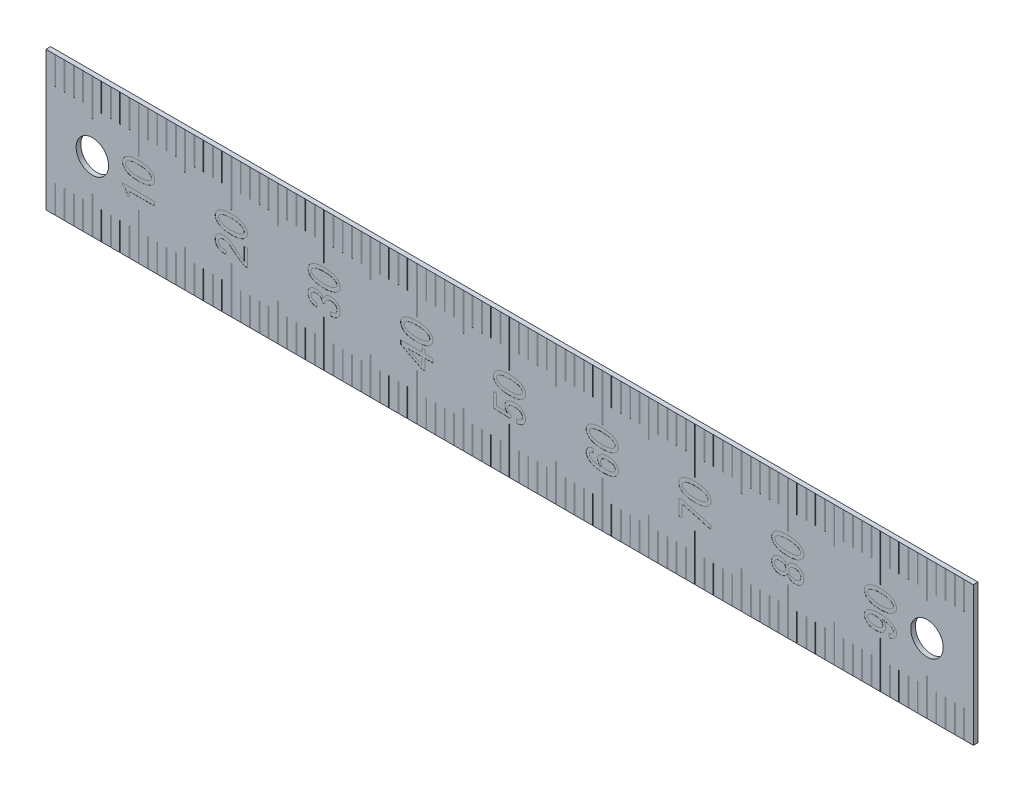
SolidWorks part; units mm, degrees
ref_plane "Front" through (0, 0, 0) normal (0, 0, 1) x (1, 0, 0)
ref_plane "Top" through (0, 0, 0) normal (0, 1, 0) x (1, 0, 0)
ref_plane "Right" through (0, 0, 0) normal (1, 0, 0) x (0, 0, -1)
sketch "Sketch1" plane through (0, 0, 0) normal (0, 0, 1) x (1, 0, 0)
  line L1 (0, -50) -> (0, 50)
  line L2 (0, -50) -> (15, -50)
  line L3 (15, -50) -> (15, 50)
  line L4 (0, 50) -> (15, 50)
  dimension "D1" = 100
  dimension "D2" = 15
extrude "Extrude1" add sketch "Sketch1" along normal blind 0.5
sketch "Sketch2" plane through (0, 0, 0.5) normal (0, 0, 1) x (1, 0, 0)
  line L0 (0, 50) -> (0, -50) construction
  line L1 (0, -50) -> (15, -50) construction
  line L2 (15, 50) -> (0, 50) construction
  circle A0 centre (7.5, -45) radius 1.75
  circle A1 centre (7.5, 45) radius 1.75
  dimension "D1" = 7.5
  dimension "D2" = 7.5
  dimension "D3" = 5
  dimension "D4" = 5
  dimension "D5" = 3.5
  dimension "D6" = 3.5
extrude "Extrude2" cut sketch "Sketch2" against normal through all
sketch "Sketch3" plane through (0, 0, 0.5) normal (0, 0, 1) x (1, 0, 0)
  line L0 (15, 50) -> (0, 50) construction
  line L1 (5.25, 28.25) -> (9.75, 28.25) construction
  line L2 (5.25, 18.25) -> (9.75, 18.25) construction
  line L3 (5.25, 8.25) -> (9.75, 8.25) construction
  line L5 (0, 50) -> (0, -50) construction
  line L6 (5.25, -1.75) -> (9.75, -1.75) construction
  line L7 (5.25, 38.25) -> (9.75, 38.25) construction
  line L8 (5.25, 38.25) -> (5.25, 41.75) construction
  line L9 (7.5, -50) -> (7.5, 50) construction
  line L10 (0, -50) -> (15, -50) construction
  line L11 (0, 40) -> (15, 40) construction
  line L12 (15, -50) -> (15, 50) construction
  line L13 (5.25, 41.75) -> (9.75, 41.75) construction
  line L14 (9.75, 38.25) -> (9.75, 41.75) construction
  line L15 (5.25, 38.25) -> (9.75, 41.75) construction
  line L16 (5.25, 41.75) -> (9.75, 38.25) construction
  line L17 (5.25, -11.75) -> (9.75, -11.75) construction
  line L18 (5.25, -21.75) -> (9.75, -21.75) construction
  line L19 (5.25, -31.75) -> (9.75, -31.75) construction
  line L20 (5.25, -41.75) -> (9.75, -41.75) construction
  circle A0 centre (7.5, 45) radius 1.75 construction
  text T0 "10" font "ＭＳ ゴシック" height 3.5
  text T1 "20" font "ＭＳ ゴシック" height 3.5
  text T2 "30" font "ＭＳ ゴシック" height 3.5
  text T3 "40" font "ＭＳ ゴシック" height 3.5
  text T4 "50  "
  text T5 "60"
  text T6 "70"
  text T7 "80"
  text T8 "90"
  point P7 (7.5, 40)
  dimension "D2" = 7.5
  dimension "D1" = 4
  dimension "D3" = 6
  dimension "D6" = 10
  dimension "D5" = 4.5
  dimension "D7" = 3.5
extrude "Extrude3" cut sketch "Sketch3" against normal blind 0.01
sketch "Sketch4" plane through (0, 0, 0.5) normal (0, 0, 1) x (1, 0, 0)
  line L0 (15, 40.05) -> (10, 40.05)
  line L1 (15, -50) -> (15, 50) construction
  line L2 (10, 40.05) -> (10, 39.95)
  line L3 (10, 39.95) -> (15, 39.95)
  line L4 (15, 39.95) -> (15, 40.05)
  line L5 (15, 50) -> (0, 50) construction
  line L6 (15, 48.05) -> (15, 47.95)
  line L7 (15, 44.95) -> (11, 44.95)
  line L8 (15, 44.95) -> (15, 45.05)
  line L9 (15, 45.05) -> (11, 45.05)
  line L10 (11, 44.95) -> (11, 45.05)
  line L11 (15, 49.05) -> (12, 49.05)
  line L12 (15, 49.05) -> (15, 48.95)
  line L13 (15, 48.95) -> (12, 48.95)
  line L14 (12, 49.05) -> (12, 48.95)
  line L15 (15, 48.05) -> (12, 48.05)
  line L16 (15, 47.95) -> (12, 47.95)
  line L17 (12, 48.05) -> (12, 47.95)
  line L18 (15, 47.05) -> (15, 46.95)
  line L19 (15, 47.05) -> (12, 47.05)
  line L20 (15, 46.95) -> (12, 46.95)
  line L21 (12, 47.05) -> (12, 46.95)
  line L22 (15, 46.05) -> (15, 45.95)
  line L23 (15, 46.05) -> (12, 46.05)
  line L24 (15, 45.95) -> (12, 45.95)
  line L25 (12, 46.05) -> (12, 45.95)
  line L26 (15, 30.05) -> (10, 30.05)
  line L27 (10, 30.05) -> (10, 29.95)
  line L28 (10, 29.95) -> (15, 29.95)
  line L29 (15, 29.95) -> (15, 30.05)
  line L30 (15, 44.05) -> (15, 43.95)
  line L31 (15, 44.05) -> (12, 44.05)
  line L32 (15, 43.95) -> (12, 43.95)
  line L33 (12, 44.05) -> (12, 43.95)
  line L34 (15, 43.05) -> (15, 42.95)
  line L35 (15, 43.05) -> (12, 43.05)
  line L36 (15, 42.95) -> (12, 42.95)
  line L37 (12, 43.05) -> (12, 42.95)
  line L38 (15, 42.05) -> (15, 41.95)
  line L39 (15, 42.05) -> (12, 42.05)
  line L40 (15, 41.95) -> (12, 41.95)
  line L41 (12, 42.05) -> (12, 41.95)
  line L42 (15, 41.05) -> (15, 40.95)
  line L43 (15, 41.05) -> (12, 41.05)
  line L44 (15, 40.95) -> (12, 40.95)
  line L45 (12, 41.05) -> (12, 40.95)
  line L46 (12, 45.05) -> (12, 44.95)
  line L47 (15, 45.05) -> (12, 45.05)
  line L48 (15, 44.95) -> (12, 44.95)
  line L49 (15, 45.05) -> (15, 44.95)
  line L50 (15, 38.05) -> (15, 37.95)
  line L51 (15, 34.95) -> (11, 34.95)
  line L52 (15, 34.95) -> (15, 35.05)
  line L53 (15, 35.05) -> (11, 35.05)
  line L54 (11, 34.95) -> (11, 35.05)
  line L55 (15, 39.05) -> (12, 39.05)
  line L56 (15, 39.05) -> (15, 38.95)
  line L57 (15, 38.95) -> (12, 38.95)
  line L58 (12, 39.05) -> (12, 38.95)
  line L59 (15, 38.05) -> (12, 38.05)
  line L60 (15, 37.95) -> (12, 37.95)
  line L61 (12, 38.05) -> (12, 37.95)
  line L62 (15, 37.05) -> (15, 36.95)
  line L63 (15, 37.05) -> (12, 37.05)
  line L64 (15, 36.95) -> (12, 36.95)
  line L65 (12, 37.05) -> (12, 36.95)
  line L66 (15, 36.05) -> (15, 35.95)
  line L67 (15, 36.05) -> (12, 36.05)
  line L68 (15, 35.95) -> (12, 35.95)
  line L69 (12, 36.05) -> (12, 35.95)
  line L70 (15, 34.05) -> (15, 33.95)
  line L71 (15, 34.05) -> (12, 34.05)
  line L72 (15, 33.95) -> (12, 33.95)
  line L73 (12, 34.05) -> (12, 33.95)
  line L74 (15, 33.05) -> (15, 32.95)
  line L75 (15, 33.05) -> (12, 33.05)
  line L76 (15, 32.95) -> (12, 32.95)
  line L77 (12, 33.05) -> (12, 32.95)
  line L78 (15, 32.05) -> (15, 31.95)
  line L79 (15, 32.05) -> (12, 32.05)
  line L80 (15, 31.95) -> (12, 31.95)
  line L81 (12, 32.05) -> (12, 31.95)
  line L82 (15, 31.05) -> (15, 30.95)
  line L83 (15, 31.05) -> (12, 31.05)
  line L84 (15, 30.95) -> (12, 30.95)
  line L85 (12, 31.05) -> (12, 30.95)
  line L86 (15, 20.05) -> (10, 20.05)
  line L87 (10, 20.05) -> (10, 19.95)
  line L88 (10, 19.95) -> (15, 19.95)
  line L89 (15, 19.95) -> (15, 20.05)
  line L90 (15, 28.05) -> (15, 27.95)
  line L91 (15, 24.95) -> (11, 24.95)
  line L92 (15, 24.95) -> (15, 25.05)
  line L93 (15, 25.05) -> (11, 25.05)
  line L94 (11, 24.95) -> (11, 25.05)
  line L95 (15, 29.05) -> (12, 29.05)
  line L96 (15, 29.05) -> (15, 28.95)
  line L97 (15, 28.95) -> (12, 28.95)
  line L98 (12, 29.05) -> (12, 28.95)
  line L99 (15, 28.05) -> (12, 28.05)
  line L100 (15, 27.95) -> (12, 27.95)
  line L101 (12, 28.05) -> (12, 27.95)
  line L102 (15, 27.05) -> (15, 26.95)
  line L103 (15, 27.05) -> (12, 27.05)
  line L104 (15, 26.95) -> (12, 26.95)
  line L105 (12, 27.05) -> (12, 26.95)
  line L106 (15, 26.05) -> (15, 25.95)
  line L107 (15, 26.05) -> (12, 26.05)
  line L108 (15, 25.95) -> (12, 25.95)
  line L109 (12, 26.05) -> (12, 25.95)
  line L110 (15, 24.05) -> (15, 23.95)
  line L111 (15, 24.05) -> (12, 24.05)
  line L112 (15, 23.95) -> (12, 23.95)
  line L113 (12, 24.05) -> (12, 23.95)
  line L114 (15, 23.05) -> (15, 22.95)
  line L115 (15, 23.05) -> (12, 23.05)
  line L116 (15, 22.95) -> (12, 22.95)
  line L117 (12, 23.05) -> (12, 22.95)
  line L118 (15, 22.05) -> (15, 21.95)
  line L119 (15, 22.05) -> (12, 22.05)
  line L120 (15, 21.95) -> (12, 21.95)
  line L121 (12, 22.05) -> (12, 21.95)
  line L122 (15, 21.05) -> (15, 20.95)
  line L123 (15, 21.05) -> (12, 21.05)
  line L124 (15, 20.95) -> (12, 20.95)
  line L125 (12, 21.05) -> (12, 20.95)
  line L126 (15, 10.05) -> (10, 10.05)
  line L127 (10, 10.05) -> (10, 9.95)
  line L128 (10, 9.95) -> (15, 9.95)
  line L129 (15, 9.95) -> (15, 10.05)
  line L130 (15, 18.05) -> (15, 17.95)
  line L131 (15, 14.95) -> (11, 14.95)
  line L132 (15, 14.95) -> (15, 15.05)
  line L133 (15, 15.05) -> (11, 15.05)
  line L134 (11, 14.95) -> (11, 15.05)
  line L135 (15, 19.05) -> (12, 19.05)
  line L136 (15, 19.05) -> (15, 18.95)
  line L137 (15, 18.95) -> (12, 18.95)
  line L138 (12, 19.05) -> (12, 18.95)
  line L139 (15, 18.05) -> (12, 18.05)
  line L140 (15, 17.95) -> (12, 17.95)
  line L141 (12, 18.05) -> (12, 17.95)
  line L142 (15, 17.05) -> (15, 16.95)
  line L143 (15, 17.05) -> (12, 17.05)
  line L144 (15, 16.95) -> (12, 16.95)
  line L145 (12, 17.05) -> (12, 16.95)
  line L146 (15, 16.05) -> (15, 15.95)
  line L147 (15, 16.05) -> (12, 16.05)
  line L148 (15, 15.95) -> (12, 15.95)
  line L149 (12, 16.05) -> (12, 15.95)
  line L150 (15, 14.05) -> (15, 13.95)
  line L151 (15, 14.05) -> (12, 14.05)
  line L152 (15, 13.95) -> (12, 13.95)
  line L153 (12, 14.05) -> (12, 13.95)
  line L154 (15, 13.05) -> (15, 12.95)
  line L155 (15, 13.05) -> (12, 13.05)
  line L156 (15, 12.95) -> (12, 12.95)
  line L157 (12, 13.05) -> (12, 12.95)
  line L158 (15, 12.05) -> (15, 11.95)
  line L159 (15, 12.05) -> (12, 12.05)
  line L160 (15, 11.95) -> (12, 11.95)
  line L161 (12, 12.05) -> (12, 11.95)
  line L162 (15, 11.05) -> (15, 10.95)
  line L163 (15, 11.05) -> (12, 11.05)
  line L164 (15, 10.95) -> (12, 10.95)
  line L165 (12, 11.05) -> (12, 10.95)
  line L166 (7.5, 50) -> (7.5, 36.693) construction
  line L167 (3, 1.05) -> (3, 0.95)
  line L168 (0, 0.95) -> (3, 0.95)
  line L169 (0, 1.05) -> (3, 1.05)
  line L170 (15, 8.05) -> (15, 7.95)
  line L171 (15, 4.95) -> (11, 4.95)
  line L172 (15, 4.95) -> (15, 5.05)
  line L173 (15, 5.05) -> (11, 5.05)
  line L174 (11, 4.95) -> (11, 5.05)
  line L175 (15, 9.05) -> (12, 9.05)
  line L176 (15, 9.05) -> (15, 8.95)
  line L177 (15, 8.95) -> (12, 8.95)
  line L178 (12, 9.05) -> (12, 8.95)
  line L179 (15, 8.05) -> (12, 8.05)
  line L180 (15, 7.95) -> (12, 7.95)
  line L181 (12, 8.05) -> (12, 7.95)
  line L182 (15, 7.05) -> (15, 6.95)
  line L183 (15, 7.05) -> (12, 7.05)
  line L184 (15, 6.95) -> (12, 6.95)
  line L185 (12, 7.05) -> (12, 6.95)
  line L186 (15, 6.05) -> (15, 5.95)
  line L187 (15, 6.05) -> (12, 6.05)
  line L188 (15, 5.95) -> (12, 5.95)
  line L189 (12, 6.05) -> (12, 5.95)
  line L190 (15, 4.05) -> (15, 3.95)
  line L191 (15, 4.05) -> (12, 4.05)
  line L192 (15, 3.95) -> (12, 3.95)
  line L193 (12, 4.05) -> (12, 3.95)
  line L194 (15, 3.05) -> (15, 2.95)
  line L195 (15, 3.05) -> (12, 3.05)
  line L196 (15, 2.95) -> (12, 2.95)
  line L197 (12, 3.05) -> (12, 2.95)
  line L198 (15, 2.05) -> (15, 1.95)
  line L199 (15, 2.05) -> (12, 2.05)
  line L200 (15, 1.95) -> (12, 1.95)
  line L201 (12, 2.05) -> (12, 1.95)
  line L202 (15, 1.05) -> (15, 0.95)
  line L203 (15, 1.05) -> (12, 1.05)
  line L204 (15, 0.95) -> (12, 0.95)
  line L205 (12, 1.05) -> (12, 0.95)
  line L206 (15, 0.05) -> (10, 0.05)
  line L207 (10, 0.05) -> (10, -0.05)
  line L208 (10, -0.05) -> (15, -0.05)
  line L209 (15, -0.05) -> (15, 0.05)
  line L210 (0, 1.05) -> (0, 0.95)
  line L211 (3, 2.05) -> (3, 1.95)
  line L212 (0, 1.95) -> (3, 1.95)
  line L213 (0, 2.05) -> (3, 2.05)
  line L214 (0, 2.05) -> (0, 1.95)
  line L215 (3, 3.05) -> (3, 2.95)
  line L216 (0, 2.95) -> (3, 2.95)
  line L217 (0, 3.05) -> (3, 3.05)
  line L218 (0, 3.05) -> (0, 2.95)
  line L219 (3, 4.05) -> (3, 3.95)
  line L220 (0, 3.95) -> (3, 3.95)
  line L221 (0, 4.05) -> (3, 4.05)
  line L222 (0, 4.05) -> (0, 3.95)
  line L223 (3, 6.05) -> (3, 5.95)
  line L224 (0, 5.95) -> (3, 5.95)
  line L225 (0, 6.05) -> (3, 6.05)
  line L226 (0, 6.05) -> (0, 5.95)
  line L227 (3, 7.05) -> (3, 6.95)
  line L228 (0, 6.95) -> (3, 6.95)
  line L229 (0, 7.05) -> (3, 7.05)
  line L230 (0, 7.05) -> (0, 6.95)
  line L231 (3, 8.05) -> (3, 7.95)
  line L232 (0, 7.95) -> (3, 7.95)
  line L233 (0, 8.05) -> (3, 8.05)
  line L234 (3, 9.05) -> (3, 8.95)
  line L235 (0, 8.95) -> (3, 8.95)
  line L236 (0, 9.05) -> (0, 8.95)
  line L237 (0, 9.05) -> (3, 9.05)
  line L238 (4, 4.95) -> (4, 5.05)
  line L239 (0, 5.05) -> (4, 5.05)
  line L240 (0, 4.95) -> (0, 5.05)
  line L241 (0, 4.95) -> (4, 4.95)
  line L242 (0, 8.05) -> (0, 7.95)
  line L243 (3, 11.05) -> (3, 10.95)
  line L244 (0, 10.95) -> (3, 10.95)
  line L245 (0, 11.05) -> (3, 11.05)
  line L246 (0, 11.05) -> (0, 10.95)
  line L247 (3, 12.05) -> (3, 11.95)
  line L248 (0, 11.95) -> (3, 11.95)
  line L249 (0, 12.05) -> (3, 12.05)
  line L250 (0, 12.05) -> (0, 11.95)
  line L251 (3, 13.05) -> (3, 12.95)
  line L252 (0, 12.95) -> (3, 12.95)
  line L253 (0, 13.05) -> (3, 13.05)
  line L254 (0, 13.05) -> (0, 12.95)
  line L255 (3, 14.05) -> (3, 13.95)
  line L256 (0, 13.95) -> (3, 13.95)
  line L257 (0, 14.05) -> (3, 14.05)
  line L258 (0, 14.05) -> (0, 13.95)
  line L259 (3, 16.05) -> (3, 15.95)
  line L260 (0, 15.95) -> (3, 15.95)
  line L261 (0, 16.05) -> (3, 16.05)
  line L262 (0, 16.05) -> (0, 15.95)
  line L263 (3, 17.05) -> (3, 16.95)
  line L264 (0, 16.95) -> (3, 16.95)
  line L265 (0, 17.05) -> (3, 17.05)
  line L266 (0, 17.05) -> (0, 16.95)
  line L267 (3, 18.05) -> (3, 17.95)
  line L268 (0, 17.95) -> (3, 17.95)
  line L269 (0, 18.05) -> (3, 18.05)
  line L270 (3, 19.05) -> (3, 18.95)
  line L271 (0, 18.95) -> (3, 18.95)
  line L272 (0, 19.05) -> (0, 18.95)
  line L273 (0, 19.05) -> (3, 19.05)
  line L274 (4, 14.95) -> (4, 15.05)
  line L275 (0, 15.05) -> (4, 15.05)
  line L276 (0, 14.95) -> (0, 15.05)
  line L277 (0, 14.95) -> (4, 14.95)
  line L278 (0, 18.05) -> (0, 17.95)
  line L279 (0, 9.95) -> (0, 10.05)
  line L280 (5, 9.95) -> (0, 9.95)
  line L281 (5, 10.05) -> (5, 9.95)
  line L282 (0, 10.05) -> (5, 10.05)
  line L283 (3, 21.05) -> (3, 20.95)
  line L284 (0, 20.95) -> (3, 20.95)
  line L285 (0, 21.05) -> (3, 21.05)
  line L286 (0, 21.05) -> (0, 20.95)
  line L287 (3, 22.05) -> (3, 21.95)
  line L288 (0, 21.95) -> (3, 21.95)
  line L289 (0, 22.05) -> (3, 22.05)
  line L290 (0, 22.05) -> (0, 21.95)
  line L291 (3, 23.05) -> (3, 22.95)
  line L292 (0, 22.95) -> (3, 22.95)
  line L293 (0, 23.05) -> (3, 23.05)
  line L294 (0, 23.05) -> (0, 22.95)
  line L295 (3, 24.05) -> (3, 23.95)
  line L296 (0, 23.95) -> (3, 23.95)
  line L297 (0, 24.05) -> (3, 24.05)
  line L298 (0, 24.05) -> (0, 23.95)
  line L299 (3, 26.05) -> (3, 25.95)
  line L300 (0, 25.95) -> (3, 25.95)
  line L301 (0, 26.05) -> (3, 26.05)
  line L302 (0, 26.05) -> (0, 25.95)
  line L303 (3, 27.05) -> (3, 26.95)
  line L304 (0, 26.95) -> (3, 26.95)
  line L305 (0, 27.05) -> (3, 27.05)
  line L306 (0, 27.05) -> (0, 26.95)
  line L307 (3, 28.05) -> (3, 27.95)
  line L308 (0, 27.95) -> (3, 27.95)
  line L309 (0, 28.05) -> (3, 28.05)
  line L310 (3, 29.05) -> (3, 28.95)
  line L311 (0, 28.95) -> (3, 28.95)
  line L312 (0, 29.05) -> (0, 28.95)
  line L313 (0, 29.05) -> (3, 29.05)
  line L314 (4, 24.95) -> (4, 25.05)
  line L315 (0, 25.05) -> (4, 25.05)
  line L316 (0, 24.95) -> (0, 25.05)
  line L317 (0, 24.95) -> (4, 24.95)
  line L318 (0, 28.05) -> (0, 27.95)
  line L319 (0, 19.95) -> (0, 20.05)
  line L320 (5, 19.95) -> (0, 19.95)
  line L321 (5, 20.05) -> (5, 19.95)
  line L322 (0, 20.05) -> (5, 20.05)
  line L323 (3, 31.05) -> (3, 30.95)
  line L324 (0, 30.95) -> (3, 30.95)
  line L325 (0, 31.05) -> (3, 31.05)
  line L326 (0, 31.05) -> (0, 30.95)
  line L327 (3, 32.05) -> (3, 31.95)
  line L328 (0, 31.95) -> (3, 31.95)
  line L329 (0, 32.05) -> (3, 32.05)
  line L330 (0, 32.05) -> (0, 31.95)
  line L331 (3, 33.05) -> (3, 32.95)
  line L332 (0, 32.95) -> (3, 32.95)
  line L333 (0, 33.05) -> (3, 33.05)
  line L334 (0, 33.05) -> (0, 32.95)
  line L335 (3, 34.05) -> (3, 33.95)
  line L336 (0, 33.95) -> (3, 33.95)
  line L337 (0, 34.05) -> (3, 34.05)
  line L338 (0, 34.05) -> (0, 33.95)
  line L339 (3, 36.05) -> (3, 35.95)
  line L340 (0, 35.95) -> (3, 35.95)
  line L341 (0, 36.05) -> (3, 36.05)
  line L342 (0, 36.05) -> (0, 35.95)
  line L343 (3, 37.05) -> (3, 36.95)
  line L344 (0, 36.95) -> (3, 36.95)
  line L345 (0, 37.05) -> (3, 37.05)
  line L346 (0, 37.05) -> (0, 36.95)
  line L347 (3, 38.05) -> (3, 37.95)
  line L348 (0, 37.95) -> (3, 37.95)
  line L349 (0, 38.05) -> (3, 38.05)
  line L350 (3, 39.05) -> (3, 38.95)
  line L351 (0, 38.95) -> (3, 38.95)
  line L352 (0, 39.05) -> (0, 38.95)
  line L353 (0, 39.05) -> (3, 39.05)
  line L354 (4, 34.95) -> (4, 35.05)
  line L355 (0, 35.05) -> (4, 35.05)
  line L356 (0, 34.95) -> (0, 35.05)
  line L357 (0, 34.95) -> (4, 34.95)
  line L358 (0, 38.05) -> (0, 37.95)
  line L359 (3, 41.05) -> (3, 40.95)
  line L360 (0, 40.95) -> (3, 40.95)
  line L361 (0, 41.05) -> (3, 41.05)
  line L362 (0, 41.05) -> (0, 40.95)
  line L363 (3, 42.05) -> (3, 41.95)
  line L364 (0, 41.95) -> (3, 41.95)
  line L365 (0, 42.05) -> (3, 42.05)
  line L366 (0, 42.05) -> (0, 41.95)
  line L367 (3, 43.05) -> (3, 42.95)
  line L368 (0, 42.95) -> (3, 42.95)
  line L369 (0, 43.05) -> (3, 43.05)
  line L370 (0, 43.05) -> (0, 42.95)
  line L371 (3, 44.05) -> (3, 43.95)
  line L372 (0, 43.95) -> (3, 43.95)
  line L373 (0, 44.05) -> (3, 44.05)
  line L374 (0, 44.05) -> (0, 43.95)
  line L375 (0, 29.95) -> (0, 30.05)
  line L376 (5, 29.95) -> (0, 29.95)
  line L377 (5, 30.05) -> (5, 29.95)
  line L378 (0, 30.05) -> (5, 30.05)
  line L379 (3, 46.05) -> (3, 45.95)
  line L380 (0, 45.95) -> (3, 45.95)
  line L381 (0, 46.05) -> (3, 46.05)
  line L382 (0, 46.05) -> (0, 45.95)
  line L383 (3, 47.05) -> (3, 46.95)
  line L384 (0, 46.95) -> (3, 46.95)
  line L385 (0, 47.05) -> (3, 47.05)
  line L386 (0, 47.05) -> (0, 46.95)
  line L387 (3, 48.05) -> (3, 47.95)
  line L388 (0, 47.95) -> (3, 47.95)
  line L389 (0, 48.05) -> (3, 48.05)
  line L390 (3, 49.05) -> (3, 48.95)
  line L391 (0, 48.95) -> (3, 48.95)
  line L392 (0, 49.05) -> (0, 48.95)
  line L393 (0, 49.05) -> (3, 49.05)
  line L394 (4, 44.95) -> (4, 45.05)
  line L395 (0, 45.05) -> (4, 45.05)
  line L396 (0, 44.95) -> (0, 45.05)
  line L397 (0, 44.95) -> (4, 44.95)
  line L398 (0, 48.05) -> (0, 47.95)
  line L399 (0, 39.95) -> (0, 40.05)
  line L400 (5, 39.95) -> (0, 39.95)
  line L401 (5, 40.05) -> (5, 39.95)
  line L402 (0, 40.05) -> (5, 40.05)
  line L403 (15, 0.05) -> (10, 0.05)
  line L404 (10, 0.05) -> (10, -0.05)
  line L405 (10, -0.05) -> (15, -0.05)
  line L406 (15, -0.05) -> (15, 0.05)
  line L407 (3, -8.95) -> (3, -9.05)
  line L408 (0, -9.05) -> (3, -9.05)
  line L409 (0, -8.95) -> (3, -8.95)
  line L410 (15, -1.95) -> (15, -2.05)
  line L411 (15, -5.05) -> (11, -5.05)
  line L412 (15, -5.05) -> (15, -4.95)
  line L413 (15, -4.95) -> (11, -4.95)
  line L414 (11, -5.05) -> (11, -4.95)
  line L415 (15, -0.95) -> (12, -0.95)
  line L416 (15, -0.95) -> (15, -1.05)
  line L417 (15, -1.05) -> (12, -1.05)
  line L418 (12, -0.95) -> (12, -1.05)
  line L419 (15, -1.95) -> (12, -1.95)
  line L420 (15, -2.05) -> (12, -2.05)
  line L421 (12, -1.95) -> (12, -2.05)
  line L422 (15, -2.95) -> (15, -3.05)
  line L423 (15, -2.95) -> (12, -2.95)
  line L424 (15, -3.05) -> (12, -3.05)
  line L425 (12, -2.95) -> (12, -3.05)
  line L426 (15, -3.95) -> (15, -4.05)
  line L427 (15, -3.95) -> (12, -3.95)
  line L428 (15, -4.05) -> (12, -4.05)
  line L429 (12, -3.95) -> (12, -4.05)
  line L430 (15, -5.95) -> (15, -6.05)
  line L431 (15, -5.95) -> (12, -5.95)
  line L432 (15, -6.05) -> (12, -6.05)
  line L433 (12, -5.95) -> (12, -6.05)
  line L434 (15, -6.95) -> (15, -7.05)
  line L435 (15, -6.95) -> (12, -6.95)
  line L436 (15, -7.05) -> (12, -7.05)
  line L437 (12, -6.95) -> (12, -7.05)
  line L438 (15, -7.95) -> (15, -8.05)
  line L439 (15, -7.95) -> (12, -7.95)
  line L440 (15, -8.05) -> (12, -8.05)
  line L441 (12, -7.95) -> (12, -8.05)
  line L442 (15, -8.95) -> (15, -9.05)
  line L443 (15, -8.95) -> (12, -8.95)
  line L444 (15, -9.05) -> (12, -9.05)
  line L445 (12, -8.95) -> (12, -9.05)
  line L446 (0, -8.95) -> (0, -9.05)
  line L447 (3, -7.95) -> (3, -8.05)
  line L448 (0, -8.05) -> (3, -8.05)
  line L449 (0, -7.95) -> (3, -7.95)
  line L450 (0, -7.95) -> (0, -8.05)
  line L451 (3, -6.95) -> (3, -7.05)
  line L452 (0, -7.05) -> (3, -7.05)
  line L453 (0, -6.95) -> (3, -6.95)
  line L454 (0, -6.95) -> (0, -7.05)
  line L455 (3, -5.95) -> (3, -6.05)
  line L456 (0, -6.05) -> (3, -6.05)
  line L457 (0, -5.95) -> (3, -5.95)
  line L458 (0, -5.95) -> (0, -6.05)
  line L459 (3, -3.95) -> (3, -4.05)
  line L460 (0, -4.05) -> (3, -4.05)
  line L461 (0, -3.95) -> (3, -3.95)
  line L462 (0, -3.95) -> (0, -4.05)
  line L463 (3, -2.95) -> (3, -3.05)
  line L464 (0, -3.05) -> (3, -3.05)
  line L465 (0, -2.95) -> (3, -2.95)
  line L466 (0, -2.95) -> (0, -3.05)
  line L467 (3, -1.95) -> (3, -2.05)
  line L468 (0, -2.05) -> (3, -2.05)
  line L469 (0, -1.95) -> (3, -1.95)
  line L470 (3, -0.95) -> (3, -1.05)
  line L471 (0, -1.05) -> (3, -1.05)
  line L472 (0, -0.95) -> (0, -1.05)
  line L473 (0, -0.95) -> (3, -0.95)
  line L474 (4, -5.05) -> (4, -4.95)
  line L475 (0, -4.95) -> (4, -4.95)
  line L476 (0, -5.05) -> (0, -4.95)
  line L477 (0, -5.05) -> (4, -5.05)
  line L478 (0, -1.95) -> (0, -2.05)
  line L479 (0, -0.05) -> (0, 0.05)
  line L480 (5, -0.05) -> (0, -0.05)
  line L481 (5, 0.05) -> (5, -0.05)
  line L482 (0, 0.05) -> (5, 0.05)
  line L483 (15, -9.95) -> (10, -9.95)
  line L484 (10, -9.95) -> (10, -10.05)
  line L485 (10, -10.05) -> (15, -10.05)
  line L486 (15, -10.05) -> (15, -9.95)
  line L487 (3, -18.95) -> (3, -19.05)
  line L488 (0, -19.05) -> (3, -19.05)
  line L489 (0, -18.95) -> (3, -18.95)
  line L490 (15, -11.95) -> (15, -12.05)
  line L491 (15, -15.05) -> (11, -15.05)
  line L492 (15, -15.05) -> (15, -14.95)
  line L493 (15, -14.95) -> (11, -14.95)
  line L494 (11, -15.05) -> (11, -14.95)
  line L495 (15, -10.95) -> (12, -10.95)
  line L496 (15, -10.95) -> (15, -11.05)
  line L497 (15, -11.05) -> (12, -11.05)
  line L498 (12, -10.95) -> (12, -11.05)
  line L499 (15, -11.95) -> (12, -11.95)
  line L500 (15, -12.05) -> (12, -12.05)
  line L501 (12, -11.95) -> (12, -12.05)
  line L502 (15, -12.95) -> (15, -13.05)
  line L503 (15, -12.95) -> (12, -12.95)
  line L504 (15, -13.05) -> (12, -13.05)
  line L505 (12, -12.95) -> (12, -13.05)
  line L506 (15, -13.95) -> (15, -14.05)
  line L507 (15, -13.95) -> (12, -13.95)
  line L508 (15, -14.05) -> (12, -14.05)
  line L509 (12, -13.95) -> (12, -14.05)
  line L510 (15, -15.95) -> (15, -16.05)
  line L511 (15, -15.95) -> (12, -15.95)
  line L512 (15, -16.05) -> (12, -16.05)
  line L513 (12, -15.95) -> (12, -16.05)
  line L514 (15, -16.95) -> (15, -17.05)
  line L515 (15, -16.95) -> (12, -16.95)
  line L516 (15, -17.05) -> (12, -17.05)
  line L517 (12, -16.95) -> (12, -17.05)
  line L518 (15, -17.95) -> (15, -18.05)
  line L519 (15, -17.95) -> (12, -17.95)
  line L520 (15, -18.05) -> (12, -18.05)
  line L521 (12, -17.95) -> (12, -18.05)
  line L522 (15, -18.95) -> (15, -19.05)
  line L523 (15, -18.95) -> (12, -18.95)
  line L524 (15, -19.05) -> (12, -19.05)
  line L525 (12, -18.95) -> (12, -19.05)
  line L526 (0, -18.95) -> (0, -19.05)
  line L527 (3, -17.95) -> (3, -18.05)
  line L528 (0, -18.05) -> (3, -18.05)
  line L529 (0, -17.95) -> (3, -17.95)
  line L530 (0, -17.95) -> (0, -18.05)
  line L531 (3, -16.95) -> (3, -17.05)
  line L532 (0, -17.05) -> (3, -17.05)
  line L533 (0, -16.95) -> (3, -16.95)
  line L534 (0, -16.95) -> (0, -17.05)
  line L535 (3, -15.95) -> (3, -16.05)
  line L536 (0, -16.05) -> (3, -16.05)
  line L537 (0, -15.95) -> (3, -15.95)
  line L538 (0, -15.95) -> (0, -16.05)
  line L539 (3, -13.95) -> (3, -14.05)
  line L540 (0, -14.05) -> (3, -14.05)
  line L541 (0, -13.95) -> (3, -13.95)
  line L542 (0, -13.95) -> (0, -14.05)
  line L543 (3, -12.95) -> (3, -13.05)
  line L544 (0, -13.05) -> (3, -13.05)
  line L545 (0, -12.95) -> (3, -12.95)
  line L546 (0, -12.95) -> (0, -13.05)
  line L547 (3, -11.95) -> (3, -12.05)
  line L548 (0, -12.05) -> (3, -12.05)
  line L549 (0, -11.95) -> (3, -11.95)
  line L550 (3, -10.95) -> (3, -11.05)
  line L551 (0, -11.05) -> (3, -11.05)
  line L552 (0, -10.95) -> (0, -11.05)
  line L553 (0, -10.95) -> (3, -10.95)
  line L554 (4, -15.05) -> (4, -14.95)
  line L555 (0, -14.95) -> (4, -14.95)
  line L556 (0, -15.05) -> (0, -14.95)
  line L557 (0, -15.05) -> (4, -15.05)
  line L558 (0, -11.95) -> (0, -12.05)
  line L559 (0, -10.05) -> (0, -9.95)
  line L560 (5, -10.05) -> (0, -10.05)
  line L561 (5, -9.95) -> (5, -10.05)
  line L562 (0, -9.95) -> (5, -9.95)
  line L563 (15, -19.95) -> (10, -19.95)
  line L564 (10, -19.95) -> (10, -20.05)
  line L565 (10, -20.05) -> (15, -20.05)
  line L566 (15, -20.05) -> (15, -19.95)
  line L567 (3, -28.95) -> (3, -29.05)
  line L568 (0, -29.05) -> (3, -29.05)
  line L569 (0, -28.95) -> (3, -28.95)
  line L570 (15, -21.95) -> (15, -22.05)
  line L571 (15, -25.05) -> (11, -25.05)
  line L572 (15, -25.05) -> (15, -24.95)
  line L573 (15, -24.95) -> (11, -24.95)
  line L574 (11, -25.05) -> (11, -24.95)
  line L575 (15, -20.95) -> (12, -20.95)
  line L576 (15, -20.95) -> (15, -21.05)
  line L577 (15, -21.05) -> (12, -21.05)
  line L578 (12, -20.95) -> (12, -21.05)
  line L579 (15, -21.95) -> (12, -21.95)
  line L580 (15, -22.05) -> (12, -22.05)
  line L581 (12, -21.95) -> (12, -22.05)
  line L582 (15, -22.95) -> (15, -23.05)
  line L583 (15, -22.95) -> (12, -22.95)
  line L584 (15, -23.05) -> (12, -23.05)
  line L585 (12, -22.95) -> (12, -23.05)
  line L586 (15, -23.95) -> (15, -24.05)
  line L587 (15, -23.95) -> (12, -23.95)
  line L588 (15, -24.05) -> (12, -24.05)
  line L589 (12, -23.95) -> (12, -24.05)
  line L590 (15, -25.95) -> (15, -26.05)
  line L591 (15, -25.95) -> (12, -25.95)
  line L592 (15, -26.05) -> (12, -26.05)
  line L593 (12, -25.95) -> (12, -26.05)
  line L594 (15, -26.95) -> (15, -27.05)
  line L595 (15, -26.95) -> (12, -26.95)
  line L596 (15, -27.05) -> (12, -27.05)
  line L597 (12, -26.95) -> (12, -27.05)
  line L598 (15, -27.95) -> (15, -28.05)
  line L599 (15, -27.95) -> (12, -27.95)
  line L600 (15, -28.05) -> (12, -28.05)
  line L601 (12, -27.95) -> (12, -28.05)
  line L602 (15, -28.95) -> (15, -29.05)
  line L603 (15, -28.95) -> (12, -28.95)
  line L604 (15, -29.05) -> (12, -29.05)
  line L605 (12, -28.95) -> (12, -29.05)
  line L606 (0, -28.95) -> (0, -29.05)
  line L607 (3, -27.95) -> (3, -28.05)
  line L608 (0, -28.05) -> (3, -28.05)
  line L609 (0, -27.95) -> (3, -27.95)
  line L610 (0, -27.95) -> (0, -28.05)
  line L611 (3, -26.95) -> (3, -27.05)
  line L612 (0, -27.05) -> (3, -27.05)
  line L613 (0, -26.95) -> (3, -26.95)
  line L614 (0, -26.95) -> (0, -27.05)
  line L615 (3, -25.95) -> (3, -26.05)
  line L616 (0, -26.05) -> (3, -26.05)
  line L617 (0, -25.95) -> (3, -25.95)
  line L618 (0, -25.95) -> (0, -26.05)
  line L619 (3, -23.95) -> (3, -24.05)
  line L620 (0, -24.05) -> (3, -24.05)
  line L621 (0, -23.95) -> (3, -23.95)
  line L622 (0, -23.95) -> (0, -24.05)
  line L623 (3, -22.95) -> (3, -23.05)
  line L624 (0, -23.05) -> (3, -23.05)
  line L625 (0, -22.95) -> (3, -22.95)
  line L626 (0, -22.95) -> (0, -23.05)
  line L627 (3, -21.95) -> (3, -22.05)
  line L628 (0, -22.05) -> (3, -22.05)
  line L629 (0, -21.95) -> (3, -21.95)
  line L630 (3, -20.95) -> (3, -21.05)
  line L631 (0, -21.05) -> (3, -21.05)
  line L632 (0, -20.95) -> (0, -21.05)
  line L633 (0, -20.95) -> (3, -20.95)
  line L634 (4, -25.05) -> (4, -24.95)
  line L635 (0, -24.95) -> (4, -24.95)
  line L636 (0, -25.05) -> (0, -24.95)
  line L637 (0, -25.05) -> (4, -25.05)
  line L638 (0, -21.95) -> (0, -22.05)
  line L639 (0, -20.05) -> (0, -19.95)
  line L640 (5, -20.05) -> (0, -20.05)
  line L641 (5, -19.95) -> (5, -20.05)
  line L642 (0, -19.95) -> (5, -19.95)
  line L643 (15, -29.95) -> (10, -29.95)
  line L644 (10, -29.95) -> (10, -30.05)
  line L645 (10, -30.05) -> (15, -30.05)
  line L646 (15, -30.05) -> (15, -29.95)
  line L647 (3, -38.95) -> (3, -39.05)
  line L648 (0, -39.05) -> (3, -39.05)
  line L649 (0, -38.95) -> (3, -38.95)
  line L650 (15, -31.95) -> (15, -32.05)
  line L651 (15, -35.05) -> (11, -35.05)
  line L652 (15, -35.05) -> (15, -34.95)
  line L653 (15, -34.95) -> (11, -34.95)
  line L654 (11, -35.05) -> (11, -34.95)
  line L655 (15, -30.95) -> (12, -30.95)
  line L656 (15, -30.95) -> (15, -31.05)
  line L657 (15, -31.05) -> (12, -31.05)
  line L658 (12, -30.95) -> (12, -31.05)
  line L659 (15, -31.95) -> (12, -31.95)
  line L660 (15, -32.05) -> (12, -32.05)
  line L661 (12, -31.95) -> (12, -32.05)
  line L662 (15, -32.95) -> (15, -33.05)
  line L663 (15, -32.95) -> (12, -32.95)
  line L664 (15, -33.05) -> (12, -33.05)
  line L665 (12, -32.95) -> (12, -33.05)
  line L666 (15, -33.95) -> (15, -34.05)
  line L667 (15, -33.95) -> (12, -33.95)
  line L668 (15, -34.05) -> (12, -34.05)
  line L669 (12, -33.95) -> (12, -34.05)
  line L670 (15, -35.95) -> (15, -36.05)
  line L671 (15, -35.95) -> (12, -35.95)
  line L672 (15, -36.05) -> (12, -36.05)
  line L673 (12, -35.95) -> (12, -36.05)
  line L674 (15, -36.95) -> (15, -37.05)
  line L675 (15, -36.95) -> (12, -36.95)
  line L676 (15, -37.05) -> (12, -37.05)
  line L677 (12, -36.95) -> (12, -37.05)
  line L678 (15, -37.95) -> (15, -38.05)
  line L679 (15, -37.95) -> (12, -37.95)
  line L680 (15, -38.05) -> (12, -38.05)
  line L681 (12, -37.95) -> (12, -38.05)
  line L682 (15, -38.95) -> (15, -39.05)
  line L683 (15, -38.95) -> (12, -38.95)
  line L684 (15, -39.05) -> (12, -39.05)
  line L685 (12, -38.95) -> (12, -39.05)
  line L686 (0, -38.95) -> (0, -39.05)
  line L687 (3, -37.95) -> (3, -38.05)
  line L688 (0, -38.05) -> (3, -38.05)
  line L689 (0, -37.95) -> (3, -37.95)
  line L690 (0, -37.95) -> (0, -38.05)
  line L691 (3, -36.95) -> (3, -37.05)
  line L692 (0, -37.05) -> (3, -37.05)
  line L693 (0, -36.95) -> (3, -36.95)
  line L694 (0, -36.95) -> (0, -37.05)
  line L695 (3, -35.95) -> (3, -36.05)
  line L696 (0, -36.05) -> (3, -36.05)
  line L697 (0, -35.95) -> (3, -35.95)
  line L698 (0, -35.95) -> (0, -36.05)
  line L699 (3, -33.95) -> (3, -34.05)
  line L700 (0, -34.05) -> (3, -34.05)
  line L701 (0, -33.95) -> (3, -33.95)
  line L702 (0, -33.95) -> (0, -34.05)
  line L703 (3, -32.95) -> (3, -33.05)
  line L704 (0, -33.05) -> (3, -33.05)
  line L705 (0, -32.95) -> (3, -32.95)
  line L706 (0, -32.95) -> (0, -33.05)
  line L707 (3, -31.95) -> (3, -32.05)
  line L708 (0, -32.05) -> (3, -32.05)
  line L709 (0, -31.95) -> (3, -31.95)
  line L710 (3, -30.95) -> (3, -31.05)
  line L711 (0, -31.05) -> (3, -31.05)
  line L712 (0, -30.95) -> (0, -31.05)
  line L713 (0, -30.95) -> (3, -30.95)
  line L714 (4, -35.05) -> (4, -34.95)
  line L715 (0, -34.95) -> (4, -34.95)
  line L716 (0, -35.05) -> (0, -34.95)
  line L717 (0, -35.05) -> (4, -35.05)
  line L718 (0, -31.95) -> (0, -32.05)
  line L719 (0, -30.05) -> (0, -29.95)
  line L720 (5, -30.05) -> (0, -30.05)
  line L721 (5, -29.95) -> (5, -30.05)
  line L722 (0, -29.95) -> (5, -29.95)
  line L723 (15, -39.95) -> (10, -39.95)
  line L724 (10, -39.95) -> (10, -40.05)
  line L725 (10, -40.05) -> (15, -40.05)
  line L726 (15, -40.05) -> (15, -39.95)
  line L727 (3, -48.95) -> (3, -49.05)
  line L728 (0, -49.05) -> (3, -49.05)
  line L729 (0, -48.95) -> (3, -48.95)
  line L730 (15, -41.95) -> (15, -42.05)
  line L731 (15, -45.05) -> (11, -45.05)
  line L732 (15, -45.05) -> (15, -44.95)
  line L733 (15, -44.95) -> (11, -44.95)
  line L734 (11, -45.05) -> (11, -44.95)
  line L735 (15, -40.95) -> (12, -40.95)
  line L736 (15, -40.95) -> (15, -41.05)
  line L737 (15, -41.05) -> (12, -41.05)
  line L738 (12, -40.95) -> (12, -41.05)
  line L739 (15, -41.95) -> (12, -41.95)
  line L740 (15, -42.05) -> (12, -42.05)
  line L741 (12, -41.95) -> (12, -42.05)
  line L742 (15, -42.95) -> (15, -43.05)
  line L743 (15, -42.95) -> (12, -42.95)
  line L744 (15, -43.05) -> (12, -43.05)
  line L745 (12, -42.95) -> (12, -43.05)
  line L746 (15, -43.95) -> (15, -44.05)
  line L747 (15, -43.95) -> (12, -43.95)
  line L748 (15, -44.05) -> (12, -44.05)
  line L749 (12, -43.95) -> (12, -44.05)
  line L750 (15, -45.95) -> (15, -46.05)
  line L751 (15, -45.95) -> (12, -45.95)
  line L752 (15, -46.05) -> (12, -46.05)
  line L753 (12, -45.95) -> (12, -46.05)
  line L754 (15, -46.95) -> (15, -47.05)
  line L755 (15, -46.95) -> (12, -46.95)
  line L756 (15, -47.05) -> (12, -47.05)
  line L757 (12, -46.95) -> (12, -47.05)
  line L758 (15, -47.95) -> (15, -48.05)
  line L759 (15, -47.95) -> (12, -47.95)
  line L760 (15, -48.05) -> (12, -48.05)
  line L761 (12, -47.95) -> (12, -48.05)
  line L762 (15, -48.95) -> (15, -49.05)
  line L763 (15, -48.95) -> (12, -48.95)
  line L764 (15, -49.05) -> (12, -49.05)
  line L765 (12, -48.95) -> (12, -49.05)
  line L766 (0, -48.95) -> (0, -49.05)
  line L767 (3, -47.95) -> (3, -48.05)
  line L768 (0, -48.05) -> (3, -48.05)
  line L769 (0, -47.95) -> (3, -47.95)
  line L770 (0, -47.95) -> (0, -48.05)
  line L771 (3, -46.95) -> (3, -47.05)
  line L772 (0, -47.05) -> (3, -47.05)
  line L773 (0, -46.95) -> (3, -46.95)
  line L774 (0, -46.95) -> (0, -47.05)
  line L775 (3, -45.95) -> (3, -46.05)
  line L776 (0, -46.05) -> (3, -46.05)
  line L777 (0, -45.95) -> (3, -45.95)
  line L778 (0, -45.95) -> (0, -46.05)
  line L779 (3, -43.95) -> (3, -44.05)
  line L780 (0, -44.05) -> (3, -44.05)
  line L781 (0, -43.95) -> (3, -43.95)
  line L782 (0, -43.95) -> (0, -44.05)
  line L783 (3, -42.95) -> (3, -43.05)
  line L784 (0, -43.05) -> (3, -43.05)
  line L785 (0, -42.95) -> (3, -42.95)
  line L786 (0, -42.95) -> (0, -43.05)
  line L787 (3, -41.95) -> (3, -42.05)
  line L788 (0, -42.05) -> (3, -42.05)
  line L789 (0, -41.95) -> (3, -41.95)
  line L790 (3, -40.95) -> (3, -41.05)
  line L791 (0, -41.05) -> (3, -41.05)
  line L792 (0, -40.95) -> (0, -41.05)
  line L793 (0, -40.95) -> (3, -40.95)
  line L794 (4, -45.05) -> (4, -44.95)
  line L795 (0, -44.95) -> (4, -44.95)
  line L796 (0, -45.05) -> (0, -44.95)
  line L797 (0, -45.05) -> (4, -45.05)
  line L798 (0, -41.95) -> (0, -42.05)
  line L799 (0, -40.05) -> (0, -39.95)
  line L800 (5, -40.05) -> (0, -40.05)
  line L801 (5, -39.95) -> (5, -40.05)
  line L802 (0, -39.95) -> (5, -39.95)
  point P4 (15, 40)
  point P13 (15, 45)
  point P18 (15, 49)
  dimension "D1" = 10
  dimension "D2" = 0.1
  dimension "D3" = 5
  dimension "D4" = 5
  dimension "D5" = 0.1
  dimension "D6" = 1
  dimension "D7" = 0.1
  dimension "D8" = 3
  dimension "D9" = 4
  dimension "D12" = 6
  dimension "D10" = 9
  dimension "D11" = 5
extrude "Extrude4" cut sketch "Sketch4" against normal blind 0.01
move or copy body "Body-Move/Copy2" bodies to move or copy 105 copy no rotation origin (0, 0, 0) rotation axis (0, 0, 1) rotation angle 90
move or copy body "Body-Move/Copy3" bodies to move or copy 107 copy no translate (50, -7.5, 0)
